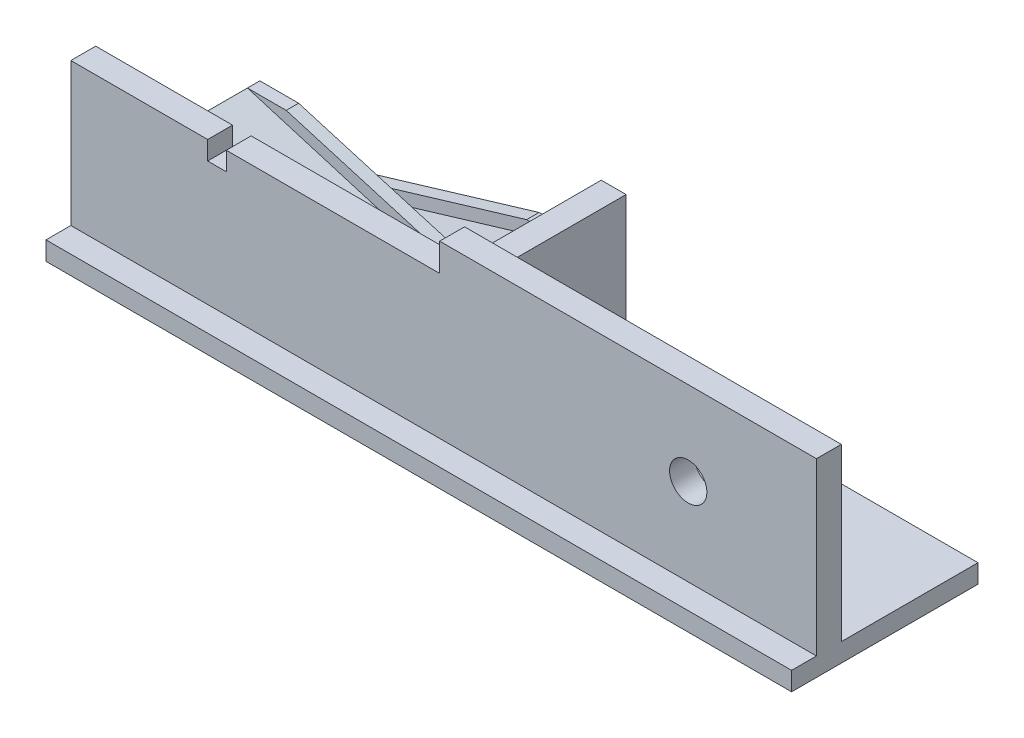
SolidWorks part; units mm, degrees
ref_plane "Alzado" through (0, 0, 0) normal (0, 0, 1) x (1, 0, 0)
ref_plane "Planta" through (0, 0, 0) normal (0, 1, 0) x (1, 0, 0)
ref_plane "Vista lateral" through (0, 0, 0) normal (1, 0, 0) x (0, 0, -1)
sketch "Croquis1" plane through (0, 0, 0) normal (0, 1, 0) x (1, 0, 0)
  line L1 (-5936.0731, 0) -> (6063.9269, 0)
  line L2 (-5936.0731, 0) -> (-5936.0731, 3000)
  line L3 (-5936.0731, 3000) -> (6063.9269, 3000)
  line L4 (6063.9269, 0) -> (6063.9269, 3000)
  dimension "D1" = 12000
  dimension "D2" = 3000
extrude "Saliente-Extruir1" add sketch "Croquis1" along normal blind 300
sketch "Croquis2" plane through (0, 300, 0) normal (0, 1, 0) x (1, 0, 0)
  line L0 (-5936.0731, 3000) -> (-5936.0731, 0) construction
  line L1 (-5936.0731, 400) -> (6063.9269, 400)
  line L2 (-5936.0731, 400) -> (-5936.0731, 800)
  line L3 (-5936.0731, 800) -> (6063.9269, 800)
  line L4 (6063.9269, 400) -> (6063.9269, 800)
  line L5 (6063.9269, 0) -> (6063.9269, 3000) construction
  line L6 (-5936.0731, 0) -> (6063.9269, 0) construction
  point P10 (0, 0)
  point P12 (0, 0)
  point P13 (0, 0)
  dimension "D1" = 400
  dimension "D2" = 400
extrude "Saliente-Extruir2" add sketch "Croquis2" along normal blind 2300
sketch "Croquis3" plane through (0, 0, -400) normal (0, 0, 1) x (1, 0, 0)
  line L0 (-5936.0731, 2600) -> (6063.9269, 2600) construction
  line L1 (-3734.2254, 2600) -> (-3434.2254, 2600)
  line L2 (-3734.2254, 2600) -> (-3734.2254, 2300)
  line L3 (-3734.2254, 2300) -> (-3434.2254, 2300)
  line L4 (-3434.2254, 2600) -> (-3434.2254, 2300)
  dimension "D1" = 300
extrude "Cortar-Extruir1" cut sketch "Croquis3" against normal blind 2300
sketch "Croquis4" plane through (0, 0, -400) normal (0, 0, 1) x (1, 0, 0)
  line L0 (-3434.2254, 2600) -> (6063.9269, 2600) construction
  circle A0 centre (4000, 1700) radius 300
  dimension "D1" = 900
  dimension "D2" = 4000
extrude "Cortar-Extruir2" cut sketch "Croquis4" against normal blind 2300
sketch "Croquis5" plane through (0, 300, 0) normal (0, 1, 0) x (1, 0, 0)
  line L0 (6063.9269, 800) -> (-5936.0731, 800) construction
  line L1 (0, 800) -> (400, 800)
  line L2 (0, 800) -> (0, 3000)
  line L3 (0, 3000) -> (400, 3000)
  line L4 (400, 800) -> (400, 3000)
  line L5 (6063.9269, 3000) -> (-5936.0731, 3000) construction
  dimension "D1" = 400
extrude "Saliente-Extruir3" add sketch "Croquis5" along normal blind 2300
sketch "Croquis6" plane through (0, 2600, 0) normal (0, 1, 0) x (1, 0, 0)
  line L0 (-3434.2254, 400) -> (6063.9269, 400) construction
  line L1 (0, 400) -> (6063.9269, 400)
  line L2 (0, 400) -> (0, 800)
  line L3 (0, 800) -> (6063.9269, 800)
  line L4 (6063.9269, 400) -> (6063.9269, 800)
extrude "Saliente-Extruir4" add sketch "Croquis6" along normal blind 450
sketch "Croquis7" plane through (0, 0, -800) normal (0, 0, -1) x (-1, 0, 0)
  line L0 (1000, 1450) -> (4835.1492, 2600)
  line L1 (3734.2254, 2600) -> (5936.0731, 2600) construction
  line L2 (0, 2600) -> (0, 300) construction
  line L4 (0, 2600) -> (3434.2254, 2600) construction
  line L5 (1000, 1450) -> (4835.1492, 300)
  line L6 (0, 300) -> (5936.0731, 300) construction
  line L7 (4835.1492, 300) -> (5936.0731, 300)
  line L8 (5936.0731, 300) -> (5936.0731, 2600)
  line L9 (5936.0731, 2600) -> (4835.1492, 2600)
  dimension "D1" = 1000
  dimension "D2" = 1150
extrude "Saliente-Extruir5" add sketch "Croquis7" along normal blind 1000
sketch "Croquis8" plane through (0, 0, -800) normal (0, 0, -1) x (-1, 0, 0)
  line L0 (4835.1492, 300) -> (1000, 1450)
  line L1 (1000, 1450) -> (1000, 950)
  line L2 (1000, 950) -> (0, 950)
  line L3 (0, 2600) -> (0, 300) construction
  line L4 (0, 950) -> (0, 300)
  line L5 (0, 300) -> (4835.1492, 300)
extrude "Saliente-Extruir6" add sketch "Croquis8" along normal blind 2000
sketch "Croquis9" plane through (0, 0, -2800) normal (0, 0, -1) x (-1, 0, 0)
  line L1 (1000, 1650) -> (0, 1650)
  line L2 (0, 2600) -> (0, 950) construction
  line L3 (0, 1650) -> (0, 300)
  line L4 (0, 300) -> (4835.1492, 300)
  line L5 (4835.1492, 300) -> (4835.1492, 500)
  line L6 (4835.1492, 500) -> (1000, 1650)
extrude "Saliente-Extruir7" add sketch "Croquis9" along normal blind 200
sketch "Croquis10" plane through (-5936.0731, 0, 0) normal (-1, 0, 0) x (0, 0, 1)
  line L0 (-800, 2600) -> (-1800, 300)
  line L1 (-1800, 300) -> (-1800, 2600)
  line L2 (-1800, 2600) -> (-800, 2600)
extrude "Cortar-Extruir3" cut sketch "Croquis10" against normal blind 1642
sketch "Croquis11" plane through (0, 0, -1800) normal (0, 0, -1) x (-1, 0, 0)
  line L0 (4294.0731, 2437.754) -> (3670.1843, 2437.754)
  line L1 (3670.1843, 2437.754) -> (1000, 1650)
  line L2 (1000, 1650) -> (1000, 1450)
  line L3 (4294.0731, 2437.754) -> (1000, 1450) construction
  line L4 (4835.1492, 2600) -> (1000, 1450) construction
  line L5 (1000, 1450) -> (4294.0731, 462.246)
  line L6 (4294.0731, 2437.754) -> (4294.0731, 462.246) construction
  line L7 (4294.0731, 462.246) -> (4294.0731, 2437.754)
extrude "Saliente-Extruir8" add sketch "Croquis11" against normal blind 200
